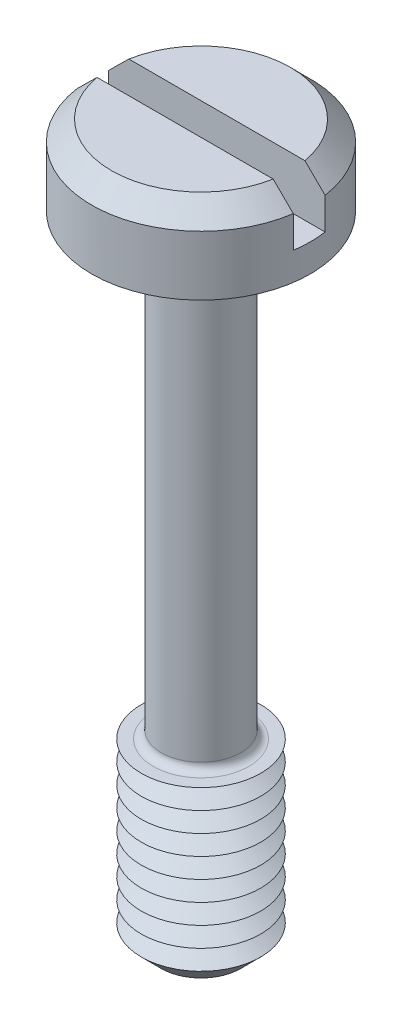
SolidWorks part; units mm, degrees
ref_plane "Front Plane" through (0, 0, 0) normal (0, 0, 1) x (1, 0, 0)
ref_plane "Top Plane" through (0, 0, 0) normal (0, 1, 0) x (1, 0, 0)
ref_plane "Right Plane" through (0, 0, 0) normal (1, 0, 0) x (0, 0, -1)
sketch "Sketch1" plane through (0, 0, 0) normal (0, 1, 0) x (1, 0, 0)
  circle A0 centre (0, 0) radius 2.75
  dimension "D1" = 5.5
extrude "Boss-Extrude1" add sketch "Sketch1" along normal blind 2
sketch "Sketch2" plane through (0, 0, 0) normal (0, -1, 0) x (1, 0, 0)
  circle A0 centre (0, 0) radius 1
  dimension "D1" = 2
extrude "Boss-Extrude2" add sketch "Sketch2" along normal blind 16
sketch "Sketch3" plane through (0, -16, 0) normal (0, -1, 0) x (1, 0, 0)
  circle A0 centre (0, 0) radius 1.5
  dimension "D1" = 3
extrude "Boss-Extrude3" add sketch "Sketch3" against normal blind 4.5
chamfer "Chamfer1" distance 0.5 angle 45 1 edges at (0, -16, -1.5)
sketch "Sketch4" plane through (0, 0, 0) normal (1, 0, 0) x (0, 0, -1)
  line L0 (0, -6.5871) -> (0, -12.0372) construction
sketch "Sketch5" plane through (0, 0, 0) normal (1, 0, 0) x (0, 0, -1)
  line L0 (-1.5, -11.5) -> (-1.067, -11.75)
  line L1 (-1.067, -11.75) -> (-1.5, -12)
  line L2 (-1.5, -11.5) -> (-1.5, -15.5) construction
  line L3 (-1.5, -12) -> (-1.5, -11.5)
  dimension "D1" = 0.5
revolve "Cut-Revolve1" cut sketch "Sketch5" angle 360 about L0
pattern_linear "LPattern1" count 8 spacing 0.5 along (0, -1, 0) of "Cut-Revolve1"
fillet "Fillet1" radius 0.2 2 edges at (0, -11.5, -1) (0, 0, -1)
chamfer "Chamfer2" distance 0.5 angle 45 1 edges at (0, 2, 2.75)
sketch "Sketch6" plane through (0, 2, 0) normal (0, 1, 0) x (1, 0, 0)
  line L1 (2.75, -0.4) -> (-2.75, -0.4)
  line L2 (2.75, -0.4) -> (2.75, 0.4)
  line L3 (2.75, 0.4) -> (-2.75, 0.4)
  line L4 (-2.75, -0.4) -> (-2.75, 0.4)
  line L5 (2.75, -0.4) -> (-2.75, 0.4) construction
  line L6 (2.75, 0.4) -> (-2.75, -0.4) construction
  circle A0 centre (0, 0) radius 2.75 construction
  point P0 (0, 0)
  dimension "D1" = 0.8
extrude "Cut-Extrude1" cut sketch "Sketch6" against normal blind 1.3
